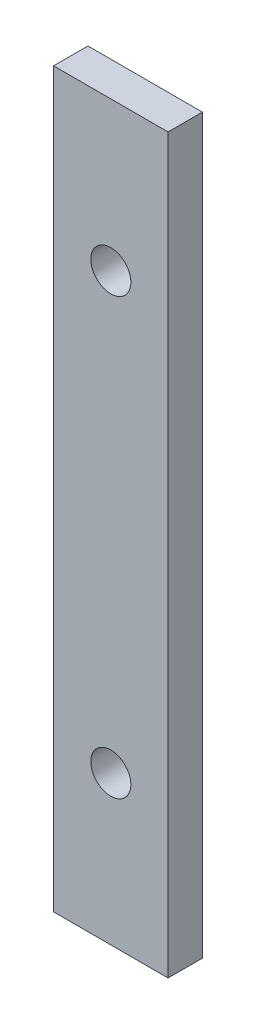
SolidWorks part; units mm, degrees
ref_plane "Front Plane" through (0, 0, 0) normal (0, 0, 1) x (1, 0, 0)
ref_plane "Top Plane" through (0, 0, 0) normal (0, 1, 0) x (1, 0, 0)
ref_plane "Right Plane" through (0, 0, 0) normal (1, 0, 0) x (0, 0, -1)
sketch "Sketch1" plane through (0, 0, 0) normal (0, 0, 1) x (1, 0, 0)
  line L0 (5, 64) -> (5, 0) construction
  line L1 (0, 0) -> (10, 0)
  line L2 (0, 0) -> (0, 64)
  line L3 (0, 64) -> (10, 64)
  line L4 (10, 0) -> (10, 64)
  line L5 (10, 32) -> (0, 32) construction
  circle A0 centre (5, 51) radius 1.75
  circle A1 centre (5, 13) radius 1.75
  dimension "D1" = 3.5
  dimension "D2" = 19
  dimension "D3" = 19
  dimension "D4" = 32
  dimension "D6" = 10
extrude "Extrude1" add sketch "Sketch1" along normal blind 3
